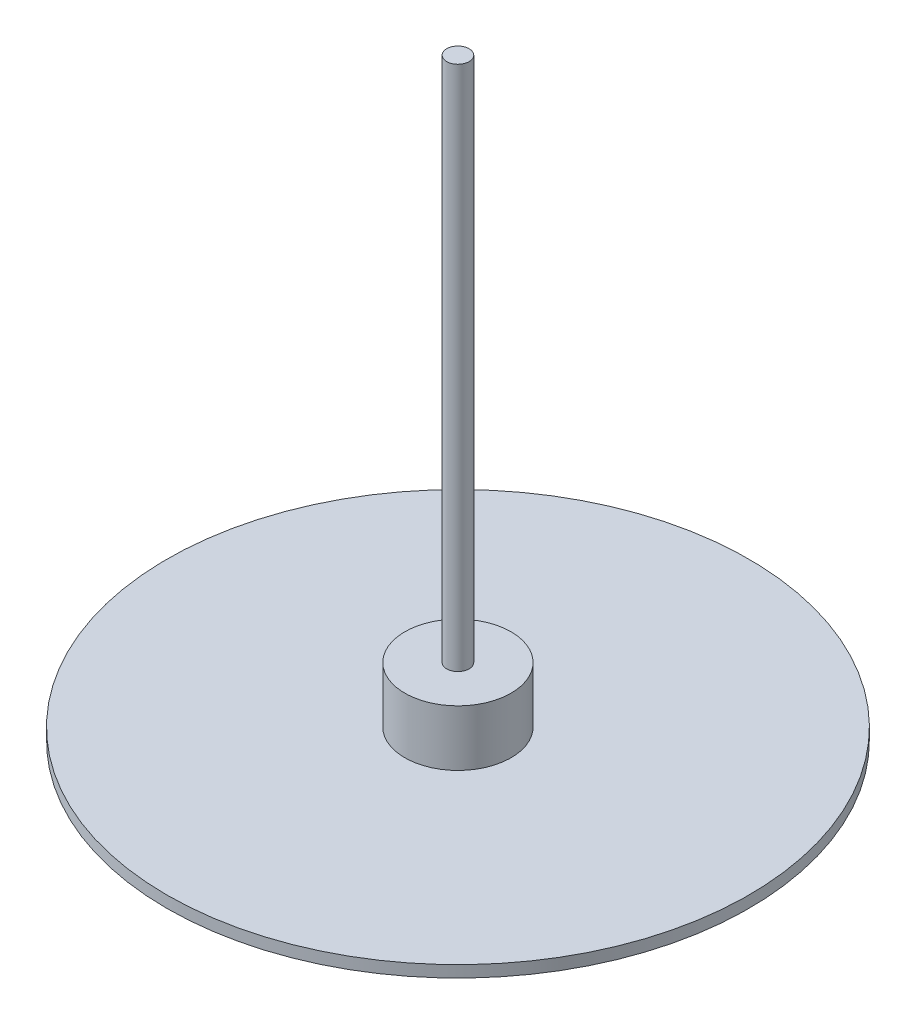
SolidWorks part; units mm, degrees
ref_plane "Front Plane" through (0, 0, 0) normal (0, 0, 1) x (1, 0, 0)
ref_plane "Top Plane" through (0, 0, 0) normal (0, 1, 0) x (1, 0, 0)
ref_plane "Right Plane" through (0, 0, 0) normal (1, 0, 0) x (0, 0, -1)
sketch "Sketch2" plane through (0, 0, 0) normal (0, 1, 0) x (1, 0, 0)
  circle A0 centre (0, 0) radius 3.175
  dimension "D1" = 6.35
extrude "Boss-Extrude2" add sketch "Sketch2" along normal blind 149.225
ref_plane "Plane1" through (0, 0, 0) normal (0, -1, 0) x (-1, 0, 0)
sketch "Sketch3" plane through (0, 0, 0) normal (0, -1, 0) x (-1, 0, 0)
  circle A0 centre (0, 0) radius 15.0813
  circle A1 centre (0, 0) radius 19.05
  dimension "D1" = 30.1625
  dimension "D2" = 38.1
extrude "Boss-Extrude3" add sketch "Sketch3" along normal blind 15.875 contours A0
ref_plane "Plane3" through (0, -15.875, 0) normal (0, -1, 0) x (-1, 0, 0)
sketch "Sketch5" plane through (0, -15.875, 0) normal (0, -1, 0) x (-1, 0, 0)
  circle A0 centre (0, 0) radius 82.55
  dimension "D1" = 165.1
extrude "Boss-Extrude5" add sketch "Sketch5" along normal blind 3.302
